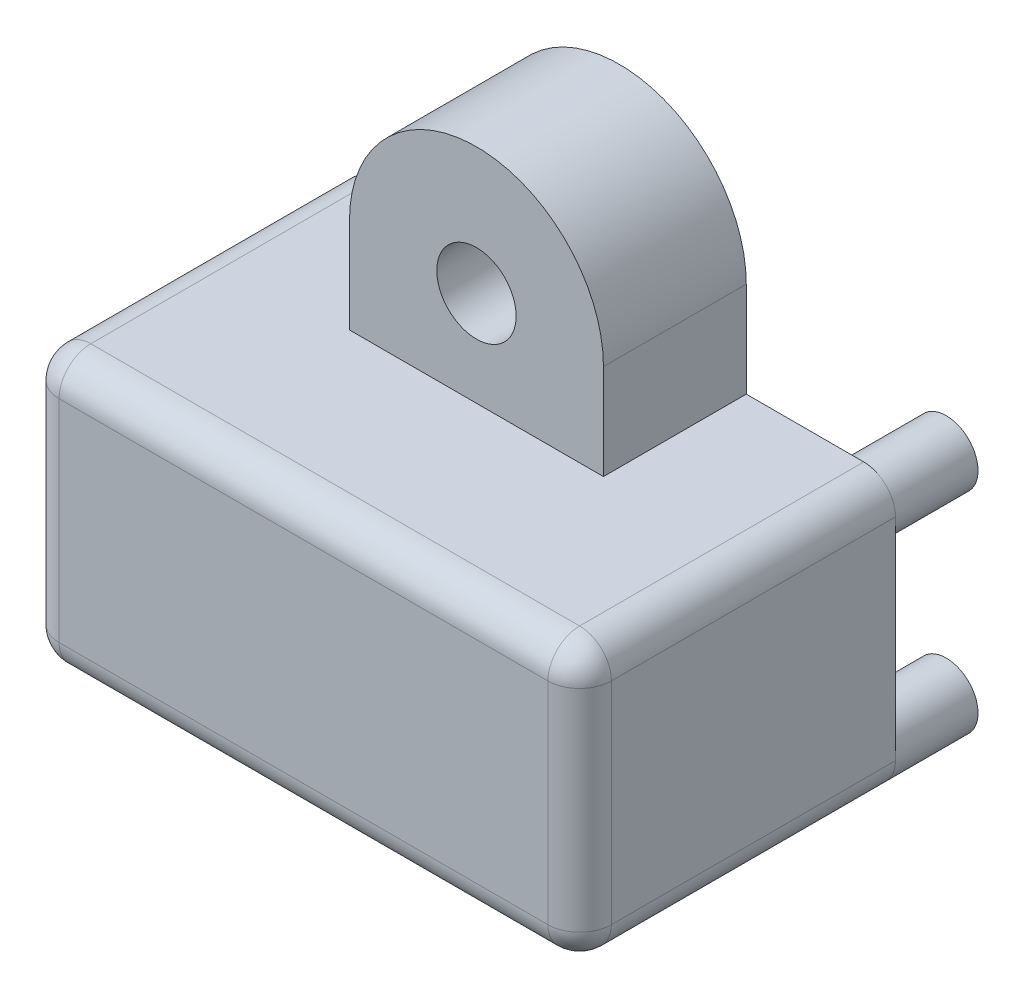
SolidWorks part; units mm, degrees
ref_plane "Plan de face" through (0, 0, 0) normal (0, 0, 1) x (1, 0, 0)
ref_plane "Plan de dessus" through (0, 0, 0) normal (0, 1, 0) x (1, 0, 0)
ref_plane "Plan de droite" through (0, 0, 0) normal (1, 0, 0) x (0, 0, -1)
sketch "Esquisse1" plane through (0, 0, 0) normal (0, 0, 1) x (1, 0, 0)
  line L1 (-42.3389, 36.2224) -> (-24.9389, 36.2224)
  line L2 (-42.3389, 36.2224) -> (-42.3389, 27.5724)
  line L3 (-42.3389, 27.5724) -> (-24.9389, 27.5724)
  line L4 (-24.9389, 36.2224) -> (-24.9389, 27.5724)
  dimension "D1" = 17.4
  dimension "D2" = 8.65
extrude "Boss.-Extru.1" add sketch "Esquisse1" along normal blind 9.95
sketch "Esquisse2" plane through (0, 0, 0) normal (0, 0, -1) x (-1, 0, 0)
  line L0 (24.9389, 36.2224) -> (42.3389, 36.2224) construction
  line L1 (42.3389, 36.2224) -> (42.3389, 27.5724) construction
  line L2 (29.6389, 39.2224) -> (29.6389, 36.2224)
  line L3 (37.6389, 39.2224) -> (37.6389, 36.2224)
  line L4 (37.6389, 36.2224) -> (29.6389, 36.2224)
  circle A0 centre (33.6389, 39.2224) radius 1.25
  arc A1 (37.6389, 39.2224) -> (29.6389, 39.2224) centre (33.6389, 39.2224) ccw
  dimension "D1" = 3
  dimension "D2" = 8.7
extrude "Boss.-Extru.2" add sketch "Esquisse2" against normal blind 4.5
sketch "Esquisse3" plane through (0, 0, 0) normal (0, 0, -1) x (-1, 0, 0)
  circle A0 centre (33.6389, 39.2224) radius 2.6
extrude "Enlèv. mat.-Extru.1" cut sketch "Esquisse3" against normal blind 2
sketch "Esquisse4" plane through (0, 0, 0) normal (0, 0, -1) x (-1, 0, 0)
  line L0 (24.9389, 27.5724) -> (24.9389, 36.2224) construction
  line L2 (42.3389, 27.5724) -> (24.9389, 27.5724) construction
  line L3 (33.6389, 36.6224) -> (33.6389, 32.9589) construction
  circle A0 centre (25.9389, 35.1849) radius 1
  circle A1 centre (25.9389, 28.5724) radius 1
  circle A2 centre (33.6389, 39.2224) radius 2.6 construction
  circle A3 centre (33.6389, 39.2224) radius 2.6 construction
  circle A4 centre (41.3389, 28.5724) radius 1
  circle A5 centre (41.3389, 35.1849) radius 1
  dimension "D1" = 1
  dimension "D2" = 1
  dimension "D3" = 1
extrude "Boss.-Extru.3" add sketch "Esquisse4" along normal blind 2.6
fillet "Congé1" radius 1 8 edges at (-33.6389, 36.2224, 9.95) (-24.9389, 31.8974, 9.95) (-33.6389, 27.5724, 9.95) (-42.3389, 31.8974, 9.95) (-24.9389, 27.5724, 4.975) (-24.9389, 36.2224, 4.975) (-42.3389, 27.5724, 4.975) (-42.3389, 36.2224, 4.975)
